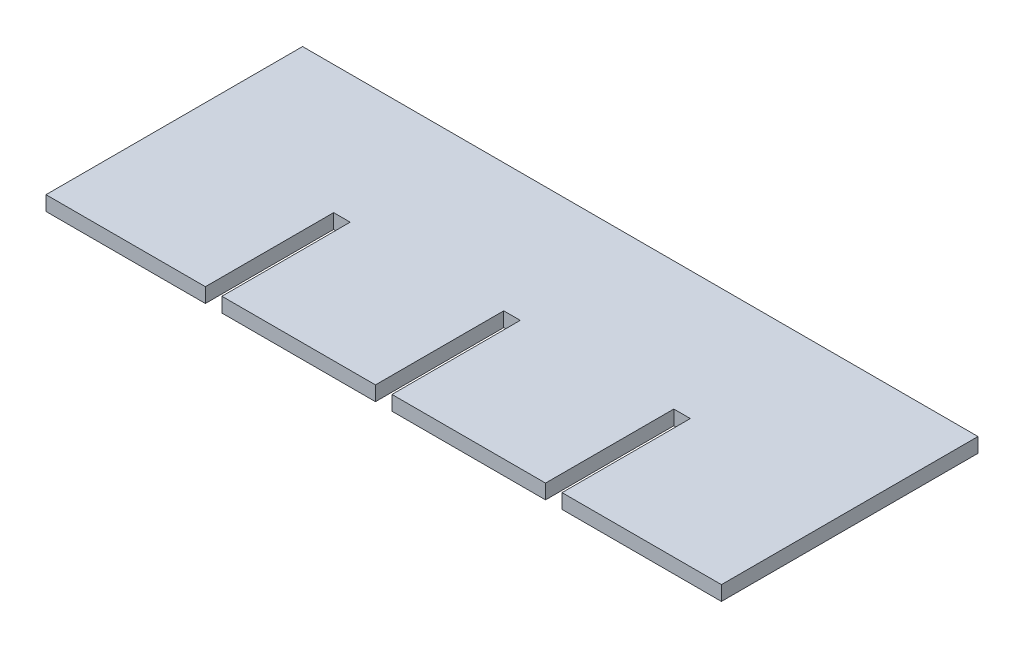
SolidWorks part; units mm, degrees
ref_plane "Alzado" through (0, 0, 0) normal (0, 0, 1) x (1, 0, 0)
ref_plane "Planta" through (0, 0, 0) normal (0, 1, 0) x (1, 0, 0)
ref_plane "Vista lateral" through (0, 0, 0) normal (1, 0, 0) x (0, 0, -1)
sketch "Croquis14" plane through (0, 0, 0) normal (0, 0, 1) x (1, 0, 0)
  line L0 (-34.75, -19.25) -> (-34.75, -20.75)
  line L1 (-35, -19) -> (35, -19) construction
  line L2 (-35, -19) -> (-35, -21) construction
  line L3 (-35, -21) -> (35, -21) construction
  line L4 (35, -19) -> (35, -21) construction
  line L5 (-34.75, -20.75) -> (34.75, -20.75)
  line L6 (34.75, -19.25) -> (34.75, -20.75)
  line L7 (-34.75, -19.25) -> (34.75, -19.25)
  dimension "D1" = 0.25
extrude "Saliente-Extruir8" add sketch "Croquis14" along normal blind 26.4
sketch "Croquis17" plane through (0, -20.75, 0) normal (0, -1, 0) x (1, 0, 0)
  line L0 (-18.35, 13.2) -> (-16.65, 13.2)
  line L3 (-18.35, 26.4) -> (-16.65, 26.4)
  line L9 (-18.35, 13.2) -> (-18.35, 26.4)
  line L10 (34.75, 26.4) -> (-34.75, 26.4) construction
  line L11 (-16.65, 13.2) -> (-16.65, 26.4)
  line L12 (-34.75, 26.4) -> (34.75, 26.4) construction
  line L13 (18.35, 26.4) -> (16.65, 26.4)
  line L14 (18.35, 26.4) -> (18.35, 13.2)
  line L15 (18.35, 13.2) -> (16.65, 13.2)
  line L16 (16.65, 26.4) -> (16.65, 13.2)
  line L17 (34.75, 26.4) -> (34.75, 0) construction
  line L19 (0.85, 26.4) -> (-0.85, 26.4)
  line L20 (0.85, 26.4) -> (0.85, 13.2)
  line L21 (0.85, 13.2) -> (-0.85, 13.2)
  line L22 (-0.85, 26.4) -> (-0.85, 13.2)
  dimension "D1" = 1.7
  dimension "D2" = 13.2
  dimension "D3" = 13.2
  dimension "D4" = 1.7
  dimension "D5" = 16.4
  dimension "D6" = 1.7
  dimension "D7" = 13.2
  dimension "D8" = 15.8
extrude "Cortar-Extruir1" cut sketch "Croquis17" against normal up to surface (1.5 mm away)
